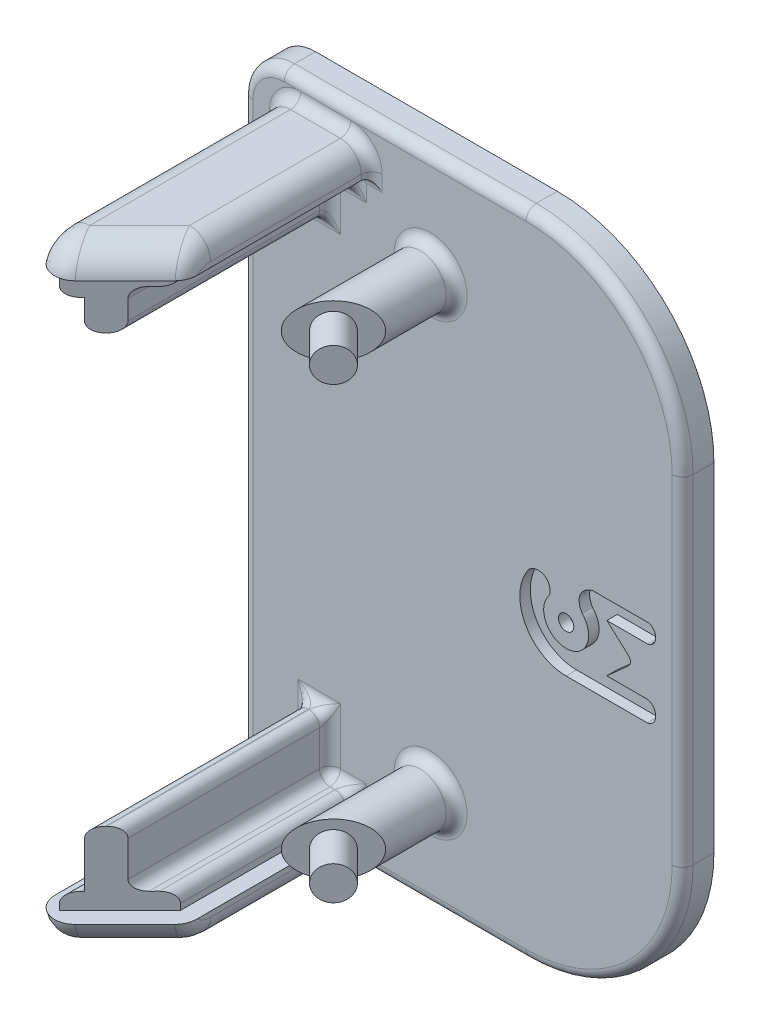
SolidWorks part; units mm, degrees
ref_plane "Front Plane" through (0, 0, 0) normal (0, 0, 1) x (1, 0, 0)
ref_plane "Top Plane" through (0, 0, 0) normal (0, 1, 0) x (1, 0, 0)
ref_plane "Right Plane" through (0, 0, 0) normal (1, 0, 0) x (0, 0, -1)
sketch "Sketch1" plane through (0, 0, 0) normal (0, 0, 1) x (1, 0, 0)
  circle A0 centre (49.5722, 9.7726) radius 2.5
  circle A1 centre (49.5722, 52.7726) radius 2.5
  dimension "D1" = 5
extrude "Boss-Extrude1" add sketch "Sketch1" along normal blind 12
sketch "Sketch2" plane through (0, 5.2784, 0) normal (0, -1, 0) x (1, 0, 0)
  line L1 (26.8033, 32.0723) -> (54.69, 32.0723)
  line L2 (26.8033, 32.0723) -> (52.2592, 6.6165)
  line L3 (26.8033, 32.0723) -> (52.2592, 6.6165)
  line L4 (54.69, 32.0723) -> (52.2592, 6.6165)
  dimension "D1" = 0.3
extrude "Cut-Extrude1" cut sketch "Sketch2" against normal through all
sketch "Sketch3" plane through (29.4378, 0, 29.4378) normal (0.7071, 0, 0.7071) x (0.7071, 0, -0.7071)
  circle A1 centre (28.4743, 9.7726) radius 1.625
  circle A2 centre (28.4743, 52.7726) radius 1.625
  dimension "D1" = 3.25
extrude "Boss-Extrude11" add sketch "Sketch3" along normal blind 4
sketch "Sketch4" plane through (0, 0, 0) normal (0, 0, 1) x (1, 0, 0)
  line L0 (52.4713, 5.2784) -> (52.4713, 57.2784) construction
  line L1 (52.4713, 31.2784) -> (11.8863, 31.2784) construction
  line L2 (34.7559, 5.2784) -> (28.1539, 5.2784) construction
  line L3 (28.1539, 5.2784) -> (27.0155, 5.2784) construction
  line L4 (32.7517, 5.2784) -> (28.1539, 5.2784)
  line L5 (28.1539, 5.2784) -> (27.0155, 5.2784)
  line L6 (32.7517, 6.2784) -> (28.1539, 6.2784)
  line L7 (28.1539, 6.2784) -> (27.442, 6.2784)
  line L8 (28.1539, 3.7784) -> (27.0155, 3.7784)
  line L9 (32.7517, 3.7784) -> (28.1539, 3.7784)
  line L10 (23.4633, 7.3919) -> (26.0211, 7.3919)
  line L11 (24.9889, 7.3919) -> (27.0155, 5.2784) construction
  line L12 (25.7107, 8.084) -> (27.442, 6.2784) construction
  line L14 (32.7517, 6.2784) -> (32.7517, 3.7784)
  line L15 (34.7559, 6.2784) -> (28.1539, 6.2784) construction
  line L16 (34.7559, 3.7784) -> (28.1539, 3.7784) construction
  line L17 (34.7559, 5.2784) -> (28.1539, 5.2784) construction
  ellipse E2 centre (27.0155, 8.2784) end of major axis (27.0155, 5.2784) minor radius 2.1213 (24.8941, 8.2784) -> (27.0155, 5.2784) ccw construction
  ellipse E3 centre (27.0155, 8.2784) end of major axis (27.0155, 5.2784) minor radius 2.1213 (24.9889, 7.3919) -> (27.0155, 5.2784) ccw
  spline S0 degree 2 poles (27.442, 6.2784) (26.2905, 6.2328) (26.0211, 7.3919) knots 0 0 0 1 1 1
  spline S2 degree 1 poles (23.5235, 7.0714) (27.0155, 3.7784) knots 0 0 1 1 construction
  spline S3 degree 3 poles (23.5235, 7.0714) (23.6144, 6.656) (23.8952, 5.8401) (24.6195, 4.7813) (25.6693, 3.989) (26.573, 3.7784) (27.0155, 3.7784) knots -1.270803 -1.270803 -1.270803 -1.270803 -0.953103 -0.635402 -0.317701 0 0 0 0 only from (23.4633, 7.3919) to (27.0155, 3.7784)
  dimension "D1" = 1
  dimension "D2" = 1.5
sketch "Sketch11" plane through (0, 0, 0) normal (0, 0, 1) x (1, 0, 0)
  line L0 (36.6555, 4.8807) -> (42.4348, 4.8807)
  line L1 (37.8555, 6.4807) -> (37.8555, 11.8807)
  line L2 (39.9348, 6.4807) -> (39.9348, 11.8807)
  line L3 (52.4713, 31.2784) -> (11.8863, 31.2784) construction
  line L4 (39.9348, 11.8807) -> (37.8555, 11.8807)
  line L5 (39.9348, 11.8807) -> (39.9348, 60.1878) construction
  line L6 (36.6555, 6.4807) -> (36.6555, 60.9475) construction
  line L7 (37.8555, 6.4807) -> (36.6555, 6.4807)
  line L8 (36.6555, 4.8807) -> (36.6555, 6.4807)
  line L9 (37.8555, 11.8807) -> (37.8555, 60.1878) construction
  line L10 (42.4348, 6.4807) -> (42.4348, 61.454) construction
  line L11 (39.9348, 6.4807) -> (42.4348, 6.4807)
  line L12 (42.4348, 4.8807) -> (42.4348, 6.4807)
  line L13 (36.6555, 58.2559) -> (42.4348, 58.2559)
  line L14 (42.4348, 58.2559) -> (42.4348, 56.6559)
  line L15 (42.4348, 56.6559) -> (39.9348, 56.6559)
  line L16 (39.9348, 56.6559) -> (39.9348, 52.8014)
  line L17 (39.9348, 52.8014) -> (37.8555, 52.8014)
  line L18 (37.8555, 52.8014) -> (37.8555, 55.7559)
  line L19 (37.8555, 55.7559) -> (36.6555, 55.7559)
  line L20 (36.6555, 55.7559) -> (36.6555, 58.2559)
  dimension "D1" = 1.6
  dimension "D2" = 2.5
  dimension "D3" = 1.6
  dimension "D4" = 1.6
  dimension "D5" = 1.2
extrude "Boss-Extrude9" add sketch "Sketch11" along normal blind 23
sketch "Sketch12" plane through (0, 5.2784, 0) normal (0, -1, 0) x (1, 0, 0)
  line L0 (43.1151, 16.1445) -> (35.3217, 23.9883)
  line L1 (35.3217, 23.9883) -> (38.352, 26.0464)
  line L2 (38.352, 26.0464) -> (51.5805, 20.4517)
  line L3 (51.5805, 20.4517) -> (43.1151, 16.1445)
extrude "Cut-Extrude6" cut sketch "Sketch12" against normal up to surface and the other way up to surface
sketch "Sketch13" plane through (0, 0, 0) normal (0, 0, 1) x (1, 0, 0)
  line L0 (42.4348, 6.4807) -> (42.4348, 4.8807) construction
  line L1 (35.1555, 2.3807) -> (35.1555, 4.8807)
  line L2 (43.9348, 4.8807) -> (43.9348, 2.3807)
  line L3 (43.9348, 2.3807) -> (35.1555, 2.3807)
  line L4 (35.1555, 4.8807) -> (43.9348, 4.8807)
  line L6 (52.4713, 31.2784) -> (11.8863, 31.2784) construction
  line L7 (52.4713, 5.2784) -> (52.4713, 57.2784) construction
  line L8 (43.9348, 58.2717) -> (43.9348, 60.7717)
  line L9 (43.9348, 60.7717) -> (35.1555, 60.7717)
  line L10 (43.9348, 58.2717) -> (35.1555, 58.2717)
  line L11 (35.1555, 58.2717) -> (35.1555, 60.7717)
  dimension "D1" = 2.5
  dimension "D2" = 2.5
  dimension "D3" = 1.5
extrude "Boss-Extrude10" add sketch "Sketch13" along normal blind 27
sketch "Sketch14" plane through (0, 5.2784, 0) normal (0, 1, 0) x (1, 0, 0)
  line L0 (45.0913, -16.4713) -> (34.4268, -27.15)
  line L1 (34.4268, -27.15) -> (42.7839, -30.8366)
  line L2 (42.7839, -30.8366) -> (51.6362, -30.1219)
  line L3 (51.6362, -30.1219) -> (53.9172, -23.7765)
  line L4 (53.9172, -23.7765) -> (45.0913, -16.4713)
extrude "Cut-Extrude7" cut sketch "Sketch14" against normal blind 26 and the other way through all
fillet "Fillet1" radius 3 1 edges at (39.5452, 2.3807, 22.0248)
fillet "Fillet2" radius 2 4 edges at (43.9348, 3.0894, 16.1837) (35.1555, 2.3807, 11.1171) (43.9348, 2.3807, 6.7216) (35.1555, 3.0894, 24.9746)
ref_plane "Plane1" through (0, 31.2784, 0) normal (0, 1, 0) x (0, 0, 1)
fillet "Fillet3" radius 3 1 edges at (39.5452, 60.7717, 22.0248)
fillet "Fillet4" radius 2 4 edges at (35.1555, 60.063, 24.9746) (43.9348, 60.063, 16.1837) (35.1555, 60.7717, 11.1171) (43.9348, 60.7717, 6.7216)
sketch "Sketch15" plane through (0, 0, 0) normal (0, 0, 1) x (1, 0, 0)
  line L0 (37.1555, 60.7717) -> (41.9348, 60.7717) construction
  line L1 (31.5543, 62.7717) -> (73.7149, 62.7717)
  line L2 (31.5543, 62.7717) -> (31.5543, 0.3807)
  line L3 (31.5543, 0.3807) -> (73.7149, 0.3807)
  line L4 (73.7149, 62.7717) -> (73.7149, 0.3807)
  line L5 (41.9348, 2.3807) -> (37.1555, 2.3807) construction
  dimension "D1" = 2
  dimension "D2" = 2
extrude "Boss-Extrude12" add sketch "Sketch15" against normal blind 3
fillet "Fillet5" radius 1 34 edges at (43.9348, 58.5217, 0) (43.3491, 60.1859, 0) (39.5452, 60.7717, 0) (35.7413, 60.1859, 0) (35.1555, 58.5217, 0) (39.5452, 58.2717, 0) (37.8555, 54.2787, 0) (38.8952, 52.8014, 0) (39.9348, 54.7287, 0) (41.1848, 56.6559, 0) (42.4348, 57.4559, 0) (39.5452, 58.2559, 0) (36.6555, 57.0059, 0) (37.2555, 55.7559, 0) (41.1848, 6.4807, 0) (39.9348, 9.1807, 0) (38.8952, 11.8807, 0) (37.8555, 9.1807, 0) (37.2555, 6.4807, 0) (35.1555, 4.6307, 0) (35.7413, 2.9664, 0) (39.5452, 2.3807, 0) (43.3491, 2.9664, 0) (43.9348, 4.6307, 0) (52.6346, 62.7717, 0) (73.7149, 31.5762, 0) (52.6346, 0.3807, 0) (31.5543, 31.5762, 0) (52.0722, 9.7726, 0) (52.0722, 52.7726, 0)
sketch "Sketch16" plane through (0, 0, 0) normal (0, 0, 1) x (1, 0, 0)
  line L0 (312.859, 85.3333) -> (312.859, 426.6667) construction
  line L1 (62.5608, 29.675) -> (62.5608, 31.1627) construction
  line L2 (61.7928, 30.4188) -> (63.2926, 30.4188) construction
  line L3 (62.5608, 25.9828) -> (70.3387, 25.9828)
  line L4 (66.4498, 27.9433) -> (70.3568, 27.9433)
  line L5 (66.4498, 27.9433) -> (68.5103, 29.7833)
  line L6 (65.0779, 34.3387) -> (70.3568, 34.3387)
  line L7 (70.3568, 27.9433) -> (70.3568, 32.5408) construction
  line L8 (66.4643, 32.5408) -> (70.3568, 32.5408)
  line L9 (70.3568, 30.2421) -> (71.0775, 30.2421) construction
  line L10 (68.4297, 30.7607) -> (66.4643, 32.5408)
  circle A0 centre (62.5608, 30.4188) radius 0.7318
  arc A1 (60.8747, 31.758) -> (64.0861, 31.9387) centre (62.5608, 30.4188) ccw
  arc A2 (58.9245, 32.9596) -> (62.5608, 25.9828) centre (62.5608, 30.4188) ccw
  spline S0 degree 3 poles (60.812, 31.675) (61.2115, 32.1405) (60.8075, 33.725) (59.2728, 33.419) (58.9245, 32.9596) knots 0 0 0 0 0.502783 1 1 1 1
  spline S1 degree 3 poles (70.3387, 25.9828) (70.8165, 26.026) (71.462, 26.9742) (70.8039, 27.8735) (70.3568, 27.9433) knots 0 0 0 0 0.510068 1 1 1 1
  spline S2 degree 2 poles (68.5103, 29.7833) (68.9741, 30.2552) (68.4297, 30.7607) knots 0 0 0 1 1 1
  spline S3 degree 3 poles (64.0861, 31.9387) (63.8582, 32.2965) (63.5699, 33.4196) (64.531, 34.2166) (65.0779, 34.3387) knots 0 0 0 0 0.42958 1 1 1 1
  spline S4 degree 3 poles (70.3568, 32.5408) (70.6394, 32.565) (71.041, 32.8626) (71.188, 33.5143) (70.9761, 34.1013) (70.5887, 34.3348) (70.3568, 34.3387) knots 0 0 0 0 0.321053 0.517682 0.738255 1 1 1 1
extrude "Cut-Extrude8" cut sketch "Sketch16" against normal blind 1 contours L8 S4 L6 S3 A1 S0 A2 L3 S1 L4 L5 S2 L10 | A0
fillet "Fillet6" radius 15 4 edges at (73.422, 0.6735, -0.2929) (73.422, 62.4788, -0.2929) (73.7149, 62.7717, -2) (73.7149, 0.3807, -2)
fillet "Fillet7" radius 4 4 edges at (31.8472, 62.4788, -0.2929) (31.8472, 0.6735, -0.2929) (31.5543, 0.3807, -2) (31.5543, 62.7717, -2)
fillet "Fillet8" radius 1 10 edges at (36.3626, 6.7735, 0.2929) (37.5626, 12.1735, 0.2929) (40.2277, 12.1735, 0.2929) (40.2277, 6.7735, 0.2929) (42.7277, 6.7735, 0.2929) (36.6555, 6.4807, 11.8229) (37.8555, 11.8807, 11.219) (39.9348, 11.8807, 10.1727) (39.9348, 6.4807, 10.1727) (42.4348, 6.4807, 8.9146)
fillet "Fillet9" radius 1 10 edges at (42.7277, 56.363, 0.2929) (40.2277, 56.363, 0.2929) (40.2277, 52.5085, 0.2929) (37.5626, 52.5085, 0.2929) (36.3626, 55.463, 0.2929) (42.4348, 56.6559, 8.9146) (39.9348, 56.6559, 10.1727) (39.9348, 52.8014, 10.1727) (37.8555, 52.8014, 11.219) (36.6555, 55.7559, 11.8229)
